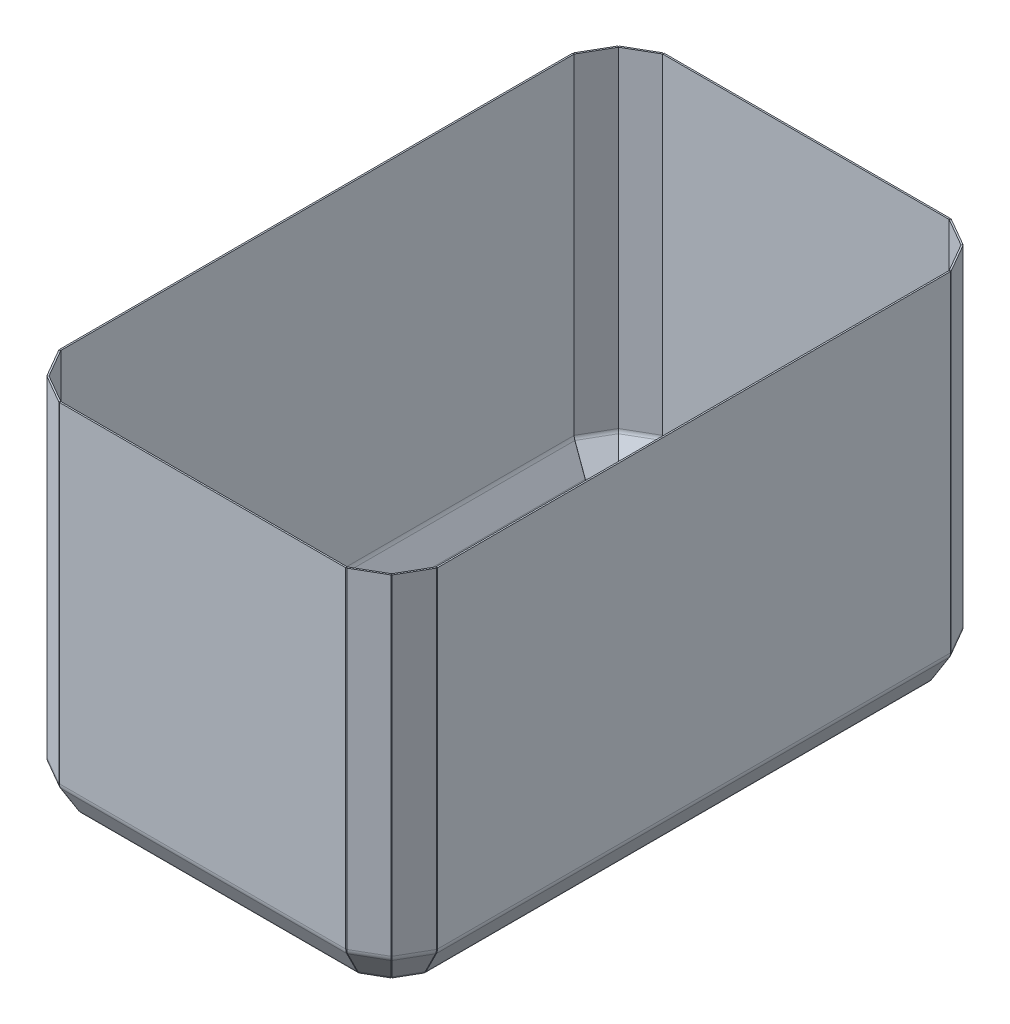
SolidWorks part; units mm, degrees
ref_plane "Ebene vorne" through (0, 0, 0) normal (0, 0, 1) x (1, 0, 0)
ref_plane "Ebene oben" through (0, 0, 0) normal (0, 1, 0) x (1, 0, 0)
ref_plane "Ebene rechts" through (0, 0, 0) normal (1, 0, 0) x (0, 0, -1)
sketch "Skizze1" plane through (0, 0, 0) normal (0, 1, 0) x (1, 0, 0)
  line L0 (-250, 340) -> (-250, -340)
  line L5 (-250, -340) -> (-228.0385, -378.0385)
  line L6 (-228.0385, -378.0385) -> (-190, -400)
  line L7 (-190, -400) -> (190, -400)
  line L8 (190, -400) -> (228.0385, -378.0385)
  line L9 (228.0385, -378.0385) -> (250, -340)
  line L10 (250, -340) -> (250, 340)
  line L11 (250, 340) -> (228.0385, 378.0385)
  line L12 (228.0385, 378.0385) -> (190, 400)
  line L13 (190, 400) -> (-190, 400)
  line L14 (-190, 400) -> (-228.0385, 378.0385)
  line L15 (-228.0385, 378.0385) -> (-250, 340)
  line L17 (250, 0) -> (-250, 0) construction
  line L18 (0, 400) -> (0, -400) construction
  point P22 (0, 0)
  dimension "D3" = 500
  dimension "A" = 60
  dimension "D4" = 800
  dimension "D5" = 150
extrude "Linear austragen1" add sketch "Skizze1" along normal blind 500
ref_plane "Ebene1" through (0, 0, -340) normal (0, 0, -1) x (-1, 0, 0)
sketch "Skizze2" plane through (0, 0, -340) normal (0, 0, -1) x (-1, 0, 0)
  line L0 (-250, 60) -> (-228.0385, 21.9615)
  line L1 (-250, 500) -> (-250, 0) construction
  line L2 (-228.0385, 21.9615) -> (-190, 0)
  line L3 (-190, 0) -> (190, 0) construction
  line L4 (-250, 60) -> (-250, 0)
  line L5 (-190, 0) -> (-250, 0)
  dimension "D1" = 150
  dimension "D2" = 150
sketch "Skizze3" plane through (0, 0, 0) normal (0, -1, 0) x (1, 0, 0)
  line L13 (-250, -340) -> (-228.0385, -378.0385)
  line L14 (-228.0385, -378.0385) -> (-190, -400)
  line L15 (-190, -400) -> (190, -400)
  line L16 (190, -400) -> (228.0385, -378.0385)
  line L17 (228.0385, -378.0385) -> (250, -340)
  line L18 (250, -340) -> (250, 340)
  line L19 (250, 340) -> (228.0385, 378.0385)
  line L20 (228.0385, 378.0385) -> (190, 400)
  line L21 (190, 400) -> (-190, 400)
  line L22 (-190, 400) -> (-228.0385, 378.0385)
  line L23 (-228.0385, 378.0385) -> (-250, 340)
  line L24 (-250, 340) -> (-250, -340)
  line L25 (-250, -340) -> (-228.0385, -378.0385)
  line L26 (-228.0385, -378.0385) -> (-190, -400)
  line L27 (-190, -400) -> (190, -400)
  line L28 (190, -400) -> (228.0385, -378.0385)
  line L29 (228.0385, -378.0385) -> (250, -340)
  line L30 (250, -340) -> (250, 340)
  line L31 (250, 340) -> (228.0385, 378.0385)
  line L32 (228.0385, 378.0385) -> (190, 400)
  line L33 (190, 400) -> (-190, 400)
  line L34 (-190, 400) -> (-228.0385, 378.0385)
  line L35 (-228.0385, 378.0385) -> (-250, 340)
  line L36 (-250, 340) -> (-250, -340)
  dimension "D1" = 0
sweep "Schnitt-Austragung2" cut profiles "Skizze2" path "Skizze3"
shell "Wandung1" thickness 2
ref_plane "Ebene2" through (-77.2724, 0, 20.7051) normal (-0.9659, 0, 0.2588) x (0.2588, 0, 0.9659)
ref_plane "Ebene3" through (75, 0, -75) normal (-0.7071, 0, 0.7071) x (0.7071, 0, 0.7071)
ref_plane "Ebene4" through (68.2532, 0, -254.7243) normal (-0.2588, 0, 0.9659) x (0.9659, 0, 0.2588)
sketch "Skizze4" plane through (68.2532, 0, -254.7243) normal (-0.2588, 0, 0.9659) x (0.9659, 0, 0.2588)
  line L0 (-329.4799, 500) -> (-329.4799, 60) construction
  line L1 (-327.4094, 500) -> (-327.4094, 60.5359) construction
  line L2 (-305.2279, 23.4256) -> (-327.4094, 60.5359) construction
  line L3 (-266.8086, 2) -> (-305.2279, 23.4256) construction
  line L4 (-267.3634, 0) -> (-306.7437, 21.9615) construction
  line L5 (-306.7437, 21.9615) -> (-329.4799, 60) construction
  line L6 (-327.4094, 502.005) -> (-327.4094, 60.5359) construction
  line L7 (-305.2279, 23.4256) -> (-327.4094, 60.5359) construction
  line L8 (-265.5133, 1.2776) -> (-305.2279, 23.4256) construction
  line L9 (-266.0681, -0.7224) -> (-306.7437, 21.9615)
  line L10 (-329.4799, 502.005) -> (-329.4799, 60)
  line L11 (-306.7437, 21.9615) -> (-329.4799, 60)
  line L12 (-327.4094, 502.005) -> (-329.4799, 502.005) construction
  line L13 (-265.5133, 1.2776) -> (-266.0681, -0.7224)
  line L14 (-265.5133, 1.2776) -> (-265.5133, 502.005)
  line L15 (-265.5133, 502.005) -> (-329.4799, 502.005)
sketch "Skizze5" plane through (75, 0, -75) normal (-0.7071, 0, 0.7071) x (0.7071, 0, 0.7071)
  line L0 (-405.8249, 21.9615) -> (-366.4446, 0) construction
  line L1 (-428.5611, 60) -> (-405.8249, 21.9615) construction
  line L2 (-428.5611, 500) -> (-428.5611, 60) construction
  line L3 (-405.8249, 21.9615) -> (-365.6435, -0.4468)
  line L4 (-428.5611, 60) -> (-405.8249, 21.9615)
  line L5 (-428.5611, 500) -> (-428.5611, 60)
  line L6 (-404.3091, 23.4256) -> (-365.8897, 2) construction
  line L7 (-404.3091, 23.4256) -> (-365.0887, 1.5532) construction
  line L8 (-365.6435, -0.4468) -> (-365.0887, 1.5532)
  line L9 (-365.0887, 1.5532) -> (-366.1672, 504.9673)
  line L10 (-366.1672, 504.9673) -> (-428.5611, 506.8259)
  line L11 (-428.5611, 506.8259) -> (-428.5611, 500)
sketch "Skizze6" plane through (-77.2724, 0, 20.7051) normal (-0.9659, 0, 0.2588) x (0.2588, 0, 0.9659)
  line L0 (-372.8746, 2) -> (-411.294, 23.4256) construction
  line L1 (-373.4294, 0) -> (-412.8097, 21.9615) construction
  line L2 (-412.8097, 21.9615) -> (-435.5459, 60) construction
  line L3 (-435.5459, 500) -> (-435.5459, 60) construction
  line L4 (-371.893, 1.4526) -> (-411.294, 23.4256) construction
  line L5 (-372.8754, -0.309) -> (-412.8097, 21.9615)
  line L6 (-412.8097, 21.9615) -> (-435.5459, 60)
  line L7 (-435.5459, 500) -> (-435.5459, 60)
  line L8 (-372.8754, -0.309) -> (-371.893, 1.4526)
  line L9 (-371.893, 1.4526) -> (-371.893, 515.2531)
  line L10 (-371.893, 515.2531) -> (-435.5459, 515.2531)
  line L11 (-435.5459, 515.2531) -> (-435.5459, 500)
extrude "Schnitt-Linear austragen1" cut sketch "Skizze4" against normal mid plane 0.1
extrude "Schnitt-Linear austragen2" cut sketch "Skizze5" against normal blind 0.1
extrude "Schnitt-Linear austragen3" cut sketch "Skizze6" against normal blind 0.1
mirror "Spiegeln1" about plane through (0, 0, 0) normal (1, 0, 0) of "Schnitt-Linear austragen3", "Schnitt-Linear austragen2", "Schnitt-Linear austragen1"
mirror "Spiegeln2" about plane through (0, 0, 0) normal (0, 0, 1) of "Spiegeln1"
sheet metal parameters "Blech1" parameters "D1"=10, "Dicke"=2
bend "Biegung-Winkel36" bend angle 30 parameters "D1"=0, "D5"=1
flatten bends "Abwickeln1" parameters "D1"=0
sketch "Skizze-Winkel1" plane through (0, 2, 0) normal (0, 1, 0) x (-1, 0, 0)
  line L0 (-189.6117, -323.9244) -> (-183.8966, -333.8233) construction
  line L1 (-232.0407, -336.9389) -> (-216.382, -364.0607) construction
  line L2 (-272.3684, -353.593) -> (-250.9687, -390.6584) construction
  line L3 (-183.7336, -333.9484) -> (-173.8796, -339.6376) construction
  line L4 (-213.971, -366.4337) -> (-186.8941, -382.0666) construction
  line L5 (-240.5688, -401.0204) -> (-203.5482, -422.3943) construction
  line L6 (-173.6759, -339.6644) -> (173.6759, -339.6644) construction
  line L7 (-183.6196, -382.9163) -> (183.6196, -382.9163) construction
  line L8 (-189.3606, -426.1681) -> (189.3606, -426.1681) construction
  line L9 (173.8796, -339.6376) -> (183.7336, -333.9484) construction
  line L10 (186.8941, -382.0666) -> (213.971, -366.4337) construction
  line L11 (203.5482, -422.3943) -> (240.5688, -401.0204) construction
  line L12 (183.8966, -333.8233) -> (189.6117, -323.9244) construction
  line L13 (216.382, -364.0607) -> (232.0407, -336.9389) construction
  line L14 (250.9687, -390.6584) -> (272.3684, -353.593) construction
  line L15 (189.6644, -323.7277) -> (189.6644, 323.7277) construction
  line L16 (232.9163, -333.6714) -> (232.9163, 333.6714) construction
  line L17 (276.1681, -339.4123) -> (276.1681, 339.4123) construction
  line L18 (189.6117, 323.9244) -> (183.8966, 333.8233) construction
  line L19 (232.0407, 336.9389) -> (216.382, 364.0607) construction
  line L20 (272.3684, 353.593) -> (250.9687, 390.6584) construction
  line L21 (183.7336, 333.9484) -> (173.8796, 339.6376) construction
  line L22 (213.971, 366.4337) -> (186.8941, 382.0666) construction
  line L23 (240.5688, 401.0204) -> (203.5482, 422.3943) construction
  line L24 (173.6759, 339.6644) -> (-173.6759, 339.6644) construction
  line L25 (183.6196, 382.9163) -> (-183.6196, 382.9163) construction
  line L26 (189.3606, 426.1681) -> (-189.3606, 426.1681) construction
  line L27 (-173.8796, 339.6376) -> (-183.7336, 333.9484) construction
  line L28 (-186.8941, 382.0666) -> (-213.971, 366.4337) construction
  line L29 (-203.5482, 422.3943) -> (-240.5688, 401.0204) construction
  line L30 (-183.8966, 333.8233) -> (-189.6117, 323.9244) construction
  line L31 (-216.382, 364.0607) -> (-232.0407, 336.9389) construction
  line L32 (-250.9687, 390.6584) -> (-272.3684, 353.593) construction
  line L33 (-189.6644, 323.7277) -> (-189.6644, -323.7277) construction
  line L34 (-232.9163, 333.6714) -> (-232.9163, -333.6714) construction
  line L35 (-276.1681, 339.4123) -> (-276.1681, -339.4123) construction
bend "Biegung-Winkel1" bend angle 30 parameters "D1"=0, "D5"=34
bend "Biegung-Winkel2" bend angle 30 parameters "D1"=0, "D5"=35
bend "Biegung-Winkel3" bend angle 30 parameters "D1"=0, "D5"=36
bend "Biegung-Winkel4" bend angle 30 parameters "D1"=0, "D5"=33
bend "Biegung-Winkel5" bend angle 30 parameters "D1"=0, "D5"=31
bend "Biegung-Winkel6" bend angle 30 parameters "D1"=0, "D5"=32
bend "Biegung-Winkel7" bend angle 30 parameters "D1"=0, "D5"=30
bend "Biegung-Winkel8" bend angle 30 parameters "D1"=0, "D5"=28
bend "Biegung-Winkel9" bend angle 30 parameters "D1"=0, "D5"=29
bend "Biegung-Winkel10" bend angle 30 parameters "D1"=0, "D5"=26
bend "Biegung-Winkel11" bend angle 30 parameters "D1"=0, "D5"=27
bend "Biegung-Winkel12" bend angle 30 parameters "D1"=0, "D5"=25
bend "Biegung-Winkel13" bend angle 30 parameters "D1"=0, "D5"=23
bend "Biegung-Winkel14" bend angle 30 parameters "D1"=0, "D5"=24
bend "Biegung-Winkel15" bend angle 30 parameters "D1"=0, "D5"=22
bend "Biegung-Winkel16" bend angle 30 parameters "D1"=0, "D5"=19
bend "Biegung-Winkel17" bend angle 30 parameters "D1"=0, "D5"=20
bend "Biegung-Winkel18" bend angle 30 parameters "D1"=0, "D5"=21
bend "Biegung-Winkel19" bend angle 30 parameters "D1"=0, "D5"=16
bend "Biegung-Winkel20" bend angle 30 parameters "D1"=0, "D5"=17
bend "Biegung-Winkel21" bend angle 30 parameters "D1"=0, "D5"=18
bend "Biegung-Winkel22" bend angle 30 parameters "D1"=0, "D5"=13
bend "Biegung-Winkel23" bend angle 30 parameters "D1"=0, "D5"=14
bend "Biegung-Winkel24" bend angle 30 parameters "D1"=0, "D5"=15
bend "Biegung-Winkel25" bend angle 30 parameters "D1"=0, "D5"=10
bend "Biegung-Winkel26" bend angle 30 parameters "D1"=0, "D5"=11
bend "Biegung-Winkel27" bend angle 30 parameters "D1"=0, "D5"=12
bend "Biegung-Winkel28" bend angle 30 parameters "D1"=0, "D5"=9
bend "Biegung-Winkel29" bend angle 30 parameters "D1"=0, "D5"=7
bend "Biegung-Winkel30" bend angle 30 parameters "D1"=0, "D5"=8
bend "Biegung-Winkel31" bend angle 30 parameters "D1"=0, "D5"=6
bend "Biegung-Winkel32" bend angle 30 parameters "D1"=0, "D5"=4
bend "Biegung-Winkel33" bend angle 30 parameters "D1"=0, "D5"=5
bend "Biegung-Winkel34" bend angle 30 parameters "D1"=0, "D5"=2
bend "Biegung-Winkel35" bend angle 30 parameters "D1"=0, "D5"=3
process bends "Abbiegen1" parameters "D1"=0
sketch "Abwicklung-Skizze1" plane through (0, 2, 0) normal (0, 1, 0) x (-1, 0, 0)
flat pattern "Abwicklung1"
sketch "Biegung-Linien1" plane through (0, 2, 0) normal (0, 1, 0) x (-1, 0, 0)
  line L0 (-276.1681, -339.4123) -> (-276.1681, 339.4123) construction
  line L1 (-232.9163, -333.6445) -> (-232.9163, 333.6445) construction
  line L2 (-189.6644, -323.6812) -> (-189.6644, 323.6812) construction
  line L3 (-272.3684, 353.593) -> (-250.9687, 390.6584) construction
  line L4 (-232.0273, 336.9621) -> (-216.3954, 364.0374) construction
  line L5 (-183.9206, 333.7816) -> (-189.5884, 323.9647) construction
  line L6 (-240.5688, 401.0204) -> (-203.5482, 422.3943) construction
  line L7 (-213.9478, 366.4471) -> (-186.9173, 382.0532) construction
  line L8 (-173.9213, 339.6135) -> (-183.7368, 333.9465) construction
  line L9 (-189.3606, 426.1681) -> (189.3606, 426.1681) construction
  line L10 (-183.5928, 382.9163) -> (183.5928, 382.9163) construction
  line L11 (173.6796, 339.6644) -> (-173.6796, 339.6644) construction
  line L12 (203.5482, 422.3943) -> (240.5688, 401.0204) construction
  line L13 (186.9173, 382.0532) -> (213.9478, 366.4471) construction
  line L14 (183.7368, 333.9465) -> (173.9213, 339.6135) construction
  line L15 (250.9687, 390.6584) -> (272.3684, 353.593) construction
  line L16 (216.3954, 364.0374) -> (232.0273, 336.9621) construction
  line L17 (189.5884, 323.9647) -> (183.9206, 333.7816) construction
  line L18 (276.1681, 339.4123) -> (276.1681, -339.4123) construction
  line L19 (232.9163, 333.6445) -> (232.9163, -333.6445) construction
  line L20 (189.6644, -323.6812) -> (189.6644, 323.6812) construction
  line L21 (272.3684, -353.593) -> (250.9687, -390.6584) construction
  line L22 (232.0273, -336.9621) -> (216.3954, -364.0374) construction
  line L23 (183.9206, -333.7816) -> (189.5884, -323.9647) construction
  line L24 (240.5688, -401.0204) -> (203.5482, -422.3943) construction
  line L25 (213.9478, -366.4471) -> (186.9173, -382.0532) construction
  line L26 (173.9213, -339.6135) -> (183.7368, -333.9465) construction
  line L27 (189.3606, -426.1681) -> (-189.3606, -426.1681) construction
  line L28 (183.5928, -382.9163) -> (-183.5928, -382.9163) construction
  line L29 (-173.6796, -339.6644) -> (173.6796, -339.6644) construction
  line L30 (-203.5482, -422.3943) -> (-240.5688, -401.0204) construction
  line L31 (-186.9173, -382.0532) -> (-213.9478, -366.4471) construction
  line L32 (-183.7368, -333.9465) -> (-173.9213, -339.6135) construction
  line L33 (-250.9687, -390.6584) -> (-272.3684, -353.593) construction
  line L34 (-216.3954, -364.0374) -> (-232.0273, -336.9621) construction
  line L35 (-189.5884, -323.9647) -> (-183.9206, -333.7816) construction
  line L36 (-276.1681, -339.4123) -> (-276.1681, 339.4123) construction
  line L37 (-232.9163, -333.6445) -> (-232.9163, 333.6445) construction
  line L38 (-189.6644, -323.6812) -> (-189.6644, 323.6812) construction
  line L39 (-272.3684, 353.593) -> (-250.9687, 390.6584) construction
  line L40 (-232.0273, 336.9621) -> (-216.3954, 364.0374) construction
  line L41 (-183.9206, 333.7816) -> (-189.5884, 323.9647) construction
  line L42 (-240.5688, 401.0204) -> (-203.5482, 422.3943) construction
  line L43 (-213.9478, 366.4471) -> (-186.9173, 382.0532) construction
  line L44 (-173.9213, 339.6135) -> (-183.7368, 333.9465) construction
  line L45 (-189.3606, 426.1681) -> (189.3606, 426.1681) construction
  line L46 (-183.5928, 382.9163) -> (183.5928, 382.9163) construction
  line L47 (173.6796, 339.6644) -> (-173.6796, 339.6644) construction
  line L48 (203.5482, 422.3943) -> (240.5688, 401.0204) construction
  line L49 (186.9173, 382.0532) -> (213.9478, 366.4471) construction
  line L50 (183.7368, 333.9465) -> (173.9213, 339.6135) construction
  line L51 (250.9687, 390.6584) -> (272.3684, 353.593) construction
  line L52 (216.3954, 364.0374) -> (232.0273, 336.9621) construction
  line L53 (189.5884, 323.9647) -> (183.9206, 333.7816) construction
  line L54 (276.1681, 339.4123) -> (276.1681, -339.4123) construction
  line L55 (232.9163, 333.6445) -> (232.9163, -333.6445) construction
  line L56 (189.6644, -323.6812) -> (189.6644, 323.6812) construction
  line L57 (272.3684, -353.593) -> (250.9687, -390.6584) construction
  line L58 (232.0273, -336.9621) -> (216.3954, -364.0374) construction
  line L59 (183.9206, -333.7816) -> (189.5884, -323.9647) construction
  line L60 (240.5688, -401.0204) -> (203.5482, -422.3943) construction
  line L61 (213.9478, -366.4471) -> (186.9173, -382.0532) construction
  line L62 (173.9213, -339.6135) -> (183.7368, -333.9465) construction
  line L63 (189.3606, -426.1681) -> (-189.3606, -426.1681) construction
  line L64 (183.5928, -382.9163) -> (-183.5928, -382.9163) construction
  line L65 (-173.6796, -339.6644) -> (173.6796, -339.6644) construction
  line L66 (-203.5482, -422.3943) -> (-240.5688, -401.0204) construction
  line L67 (-186.9173, -382.0532) -> (-213.9478, -366.4471) construction
  line L68 (-183.7368, -333.9465) -> (-173.9213, -339.6135) construction
  line L69 (-250.9687, -390.6584) -> (-272.3684, -353.593) construction
  line L70 (-216.3954, -364.0374) -> (-232.0273, -336.9621) construction
  line L71 (-189.5884, -323.9647) -> (-183.9206, -333.7816) construction
bend of the flat pattern "Abwickeln-<Biegung-Winkel1>1"
bend of the flat pattern "Abwickeln-<Biegung-Winkel2>1"
bend of the flat pattern "Abwickeln-<Biegung-Winkel3>1"
bend of the flat pattern "Abwickeln-<Biegung-Winkel4>1"
bend of the flat pattern "Abwickeln-<Biegung-Winkel5>1"
bend of the flat pattern "Abwickeln-<Biegung-Winkel6>1"
bend of the flat pattern "Abwickeln-<Biegung-Winkel7>1"
bend of the flat pattern "Abwickeln-<Biegung-Winkel8>1"
bend of the flat pattern "Abwickeln-<Biegung-Winkel9>1"
bend of the flat pattern "Abwickeln-<Biegung-Winkel10>1"
bend of the flat pattern "Abwickeln-<Biegung-Winkel11>1"
bend of the flat pattern "Abwickeln-<Biegung-Winkel12>1"
bend of the flat pattern "Abwickeln-<Biegung-Winkel13>1"
bend of the flat pattern "Abwickeln-<Biegung-Winkel14>1"
bend of the flat pattern "Abwickeln-<Biegung-Winkel15>1"
bend of the flat pattern "Abwickeln-<Biegung-Winkel16>1"
bend of the flat pattern "Abwickeln-<Biegung-Winkel17>1"
bend of the flat pattern "Abwickeln-<Biegung-Winkel18>1"
bend of the flat pattern "Abwickeln-<Biegung-Winkel19>1"
bend of the flat pattern "Abwickeln-<Biegung-Winkel20>1"
bend of the flat pattern "Abwickeln-<Biegung-Winkel21>1"
bend of the flat pattern "Abwickeln-<Biegung-Winkel22>1"
bend of the flat pattern "Abwickeln-<Biegung-Winkel23>1"
bend of the flat pattern "Abwickeln-<Biegung-Winkel24>1"
bend of the flat pattern "Abwickeln-<Biegung-Winkel25>1"
bend of the flat pattern "Abwickeln-<Biegung-Winkel26>1"
bend of the flat pattern "Abwickeln-<Biegung-Winkel27>1"
bend of the flat pattern "Abwickeln-<Biegung-Winkel28>1"
bend of the flat pattern "Abwickeln-<Biegung-Winkel29>1"
bend of the flat pattern "Abwickeln-<Biegung-Winkel30>1"
bend of the flat pattern "Abwickeln-<Biegung-Winkel31>1"
bend of the flat pattern "Abwickeln-<Biegung-Winkel32>1"
bend of the flat pattern "Abwickeln-<Biegung-Winkel33>1"
bend of the flat pattern "Abwickeln-<Biegung-Winkel34>1"
bend of the flat pattern "Abwickeln-<Biegung-Winkel35>1"
bend of the flat pattern "Abwickeln-<Biegung-Winkel36>1"
